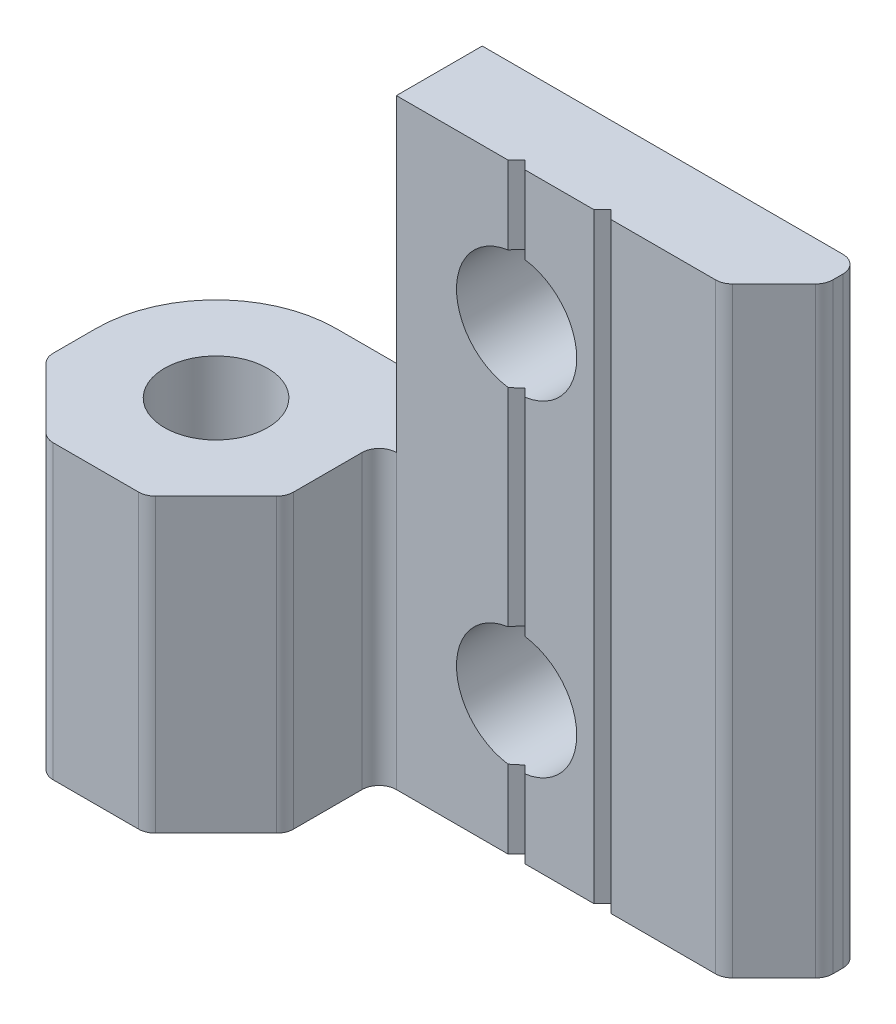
SolidWorks part; units mm, degrees
ref_plane "正面" through (0, 0, 0) normal (0, 0, 1) x (1, 0, 0)
ref_plane "平面" through (0, 0, 0) normal (0, 1, 0) x (1, 0, 0)
ref_plane "右側面" through (0, 0, 0) normal (1, 0, 0) x (0, 0, -1)
sketch "ｽｹｯﾁ1" plane through (0, 0, 0) normal (0, 1, 0) x (1, 0, 0)
  line L16 (30, 5.9142) -> (30, 6.5)
  line L17 (29.7071, 5.2071) -> (27.2929, 2.7929)
  line L18 (19.5, 2.5) -> (15.5, 2.5)
  line L19 (15, 3) -> (15.5, 2.5)
  line L20 (15, 3) -> (14.5, 2.5)
  line L21 (20, 3) -> (19.5, 2.5)
  line L22 (20, 3) -> (20.5, 2.5)
  line L23 (7, -2.4853) -> (7, 1.5)
  line L24 (14.5, 2.5) -> (8, 2.5)
  line L25 (0, 7) -> (4.634, 7)
  line L26 (-7, 0) -> (-7, -2.4853)
  line L27 (-2.4853, -7) -> (2.4853, -7)
  line L28 (-6.7071, -3.1924) -> (-3.1924, -6.7071)
  line L29 (3.1924, -6.7071) -> (6.7071, -3.1924)
  line L30 (29, 7.5) -> (5.5, 7.5)
  line L31 (26.5858, 2.5) -> (20.5, 2.5)
  arc A12 (26.5858, 2.5) -> (27.2929, 2.7929) centre (26.5858, 3.5) ccw
  arc A13 (30, 6.5) -> (29, 7.5) centre (29, 6.5) ccw
  arc A14 (29.7071, 5.2071) -> (30, 5.9142) centre (29, 5.9142) ccw
  arc A15 (8, 2.5) -> (7, 1.5) centre (8, 1.5) ccw
  arc A16 (6.7071, -3.1924) -> (7, -2.4853) centre (6, -2.4853) ccw
  arc A17 (4.634, 7) -> (5.067, 7.25) centre (4.634, 7.5) ccw
  arc A18 (0, 7) -> (-7, 0) centre (0, 0) ccw
  arc A19 (2.4853, -7) -> (3.1924, -6.7071) centre (2.4853, -6) ccw
  arc A20 (-3.1924, -6.7071) -> (-2.4853, -7) centre (-2.4853, -6) ccw
  circle A21 centre (0, 0) radius 3
  arc A22 (-7, -2.4853) -> (-6.7071, -3.1924) centre (-6, -2.4853) ccw
  arc A23 (5.5, 7.5) -> (5.067, 7.25) centre (5.5, 7) ccw
  point P42 (0, 0.001)
  point P43 (0.001, 0.001)
  point P44 (0.001, 0)
extrude "ﾎﾞｽ - 押し出し1" add sketch "ｽｹｯﾁ1" along normal blind 35
sketch "ｽｹｯﾁ2" plane through (0, 0, -7.5) normal (0, 0, -1) x (-1, 0, 0)
  line L0 (-29, 35) -> (-5.5, 35) construction
  line L2 (7, 35) -> (7, 0) construction
  line L3 (-8, 17) -> (24.7564, 17)
  line L4 (-8, 17) -> (-8, 43.6679)
  line L6 (-8, 43.6679) -> (24.7564, 43.6679)
  line L9 (24.7564, 17) -> (24.7564, 43.6679)
  dimension "D1" = 15
  dimension "D2" = 18
extrude "ｶｯﾄ - 押し出し1" cut sketch "ｽｹｯﾁ2" against normal blind 35
hole_wizard "Ø7.0 (7) 直径の穴1" positions "3Dｽｹｯﾁ1" profile "ｽｹｯﾁ3" hole size "Ø7.0" standard "Jis"
sketch3d "3Dｽｹｯﾁ1"
  line L0 (20.5, 35, -2.5) -> (26.5858, 35, -2.5) construction
  line L1 (8, 35, -2.5) -> (8, 17, -2.5) construction
  point P14 (15, 27, -2.5)
  point P16 (15, 8, -2.5)
  dimension "D1" = 8
  dimension "D2" = 19
  dimension "D3" = 7
sketch "ｽｹｯﾁ3" plane through (15, 27, -2.5) normal (1, 0, 0) x (0, -1, 0)
  line L0 (0, 0) -> (0, 32.103)
  line L1 (0, 32.103) -> (3.5, 30)
  line L2 (3.5, 30) -> (3.5, 0)
  line L5 (3.5, 0) -> (0, 0)
  line L10 (0, 32.103) -> (-3.5, 30) construction
  line L11 (0, -6.35) -> (0, 107.95) construction
  dimension "穴の直径" = 7
  dimension "穴の深さ" = 30
  dimension "ﾄﾞﾘﾙ角度" = 118
